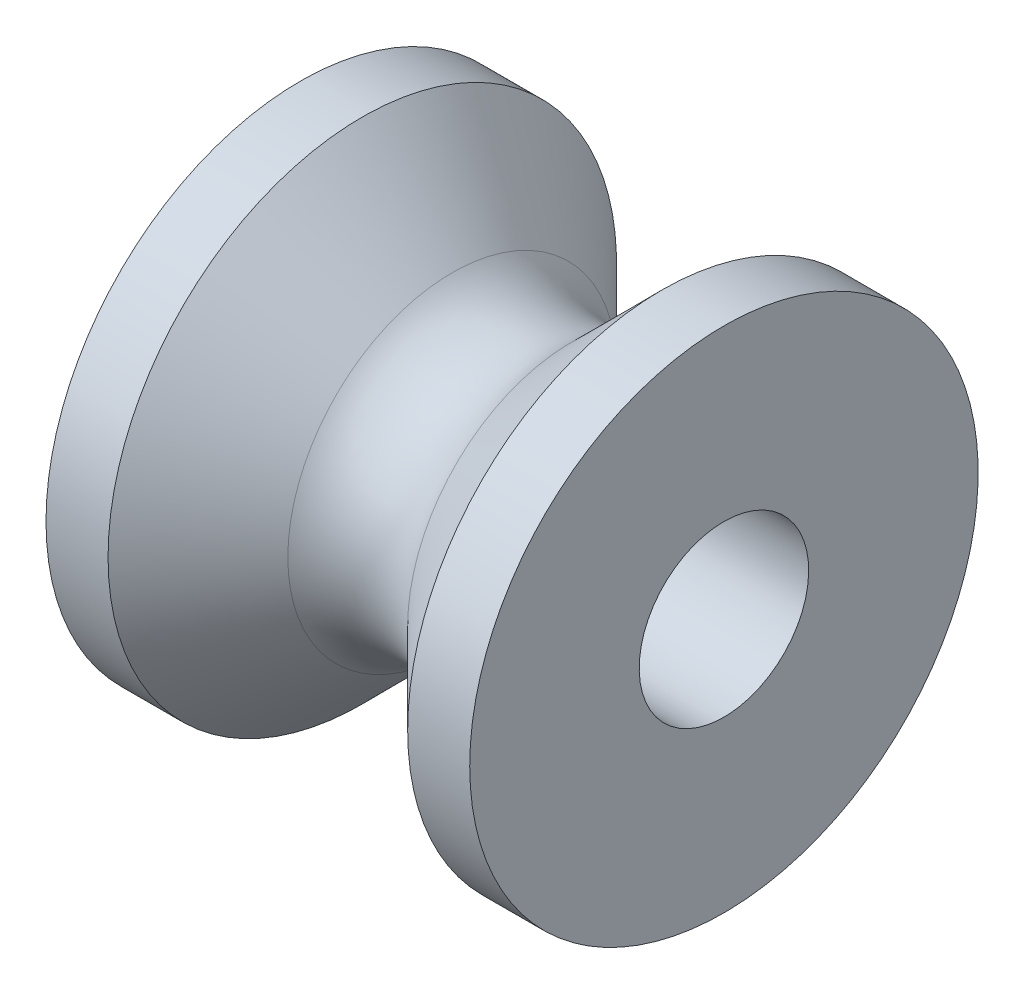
SolidWorks part; units mm, degrees
ref_plane "Front Plane" through (0, 0, 0) normal (0, 0, 1) x (1, 0, 0)
ref_plane "Top Plane" through (0, 0, 0) normal (0, 1, 0) x (1, 0, 0)
ref_plane "Right Plane" through (0, 0, 0) normal (1, 0, 0) x (0, 0, -1)
sketch "Sketch1" plane through (0, 0, 0) normal (0, 0, 1) x (1, 0, 0)
  line L0 (0, 2.4645) -> (3.5355, 6)
  line L1 (0, 2.4645) -> (-3.5355, 6)
  line L2 (-3.5355, 6) -> (-5, 6)
  line L3 (3.5355, 6) -> (5, 6)
  line L4 (-5, 6) -> (-5, 0)
  line L5 (-5, 0) -> (5, 0)
  line L6 (5, 0) -> (5, 6)
  dimension "D1" = 90
  dimension "D2" = 45
  dimension "D3" = 5
  dimension "D4" = 6
  dimension "D5" = 10
revolve "Revolve1" add sketch "Sketch1" angle 360 about L5
sketch "Sketch2" plane through (5, 0, 0) normal (1, 0, 0) x (0, 0, -1)
  circle A0 centre (0, 0) radius 2
  dimension "D1" = 4
extrude "Cut-Extrude3" cut sketch "Sketch2" against normal through all
fillet "Fillet1" radius 2 1 edges at (0, 0, 2.4645)
